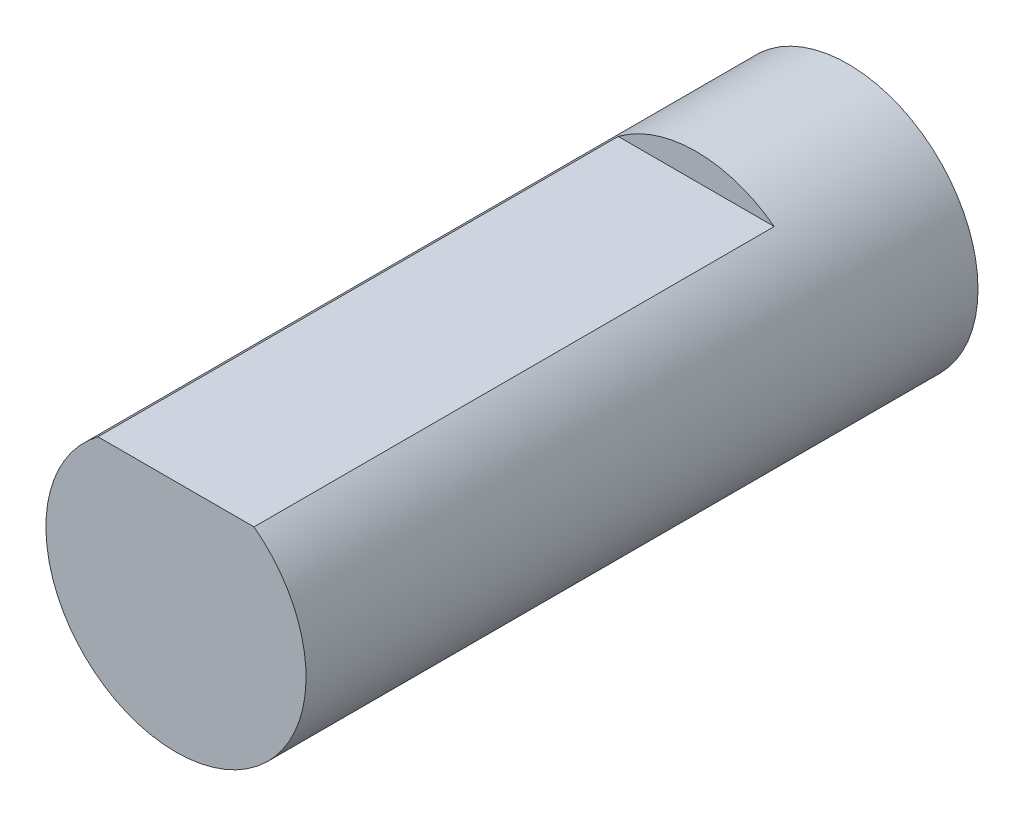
SolidWorks part; units mm, degrees
ref_plane "Plan de face" through (0, 0, 0) normal (0, 0, 1) x (1, 0, 0)
ref_plane "Plan de dessus" through (0, 0, 0) normal (0, 1, 0) x (1, 0, 0)
ref_plane "Plan de droite" through (0, 0, 0) normal (1, 0, 0) x (0, 0, -1)
sketch "Esquisse1" plane through (0, 0, 0) normal (0, 0, 1) x (1, 0, 0)
  circle A0 centre (0, 0) radius 3
  dimension "D1" = 6
extrude "Boss.-Extru.1" add sketch "Esquisse1" along normal blind 15.5
sketch "Esquisse2" plane through (0, 0, 15.5) normal (0, 0, 1) x (1, 0, 0)
  line L0 (-1.8, 2.4) -> (1.8, 2.4)
  circle A0 centre (0, 0) radius 3 construction
  arc A1 (1.8, 2.4) -> (-1.8, 2.4) centre (0, 0) ccw
  dimension "D1" = 2.4
extrude "Enlèv. mat.-Extru.1" cut sketch "Esquisse2" against normal blind 12
